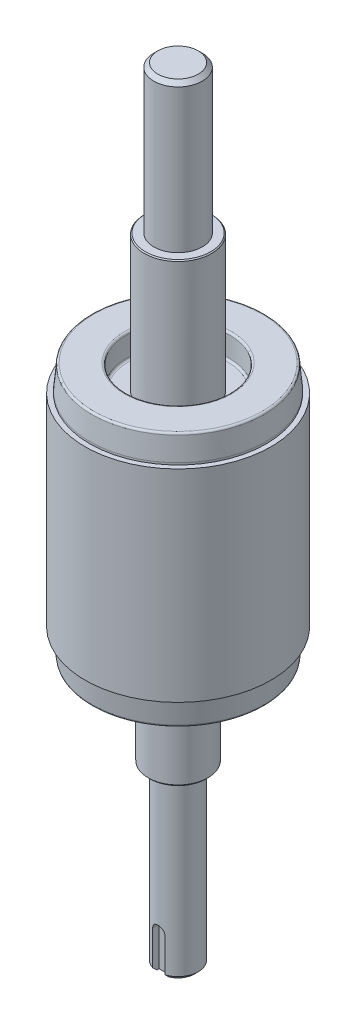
SolidWorks part; units mm, degrees
ref_plane "Plan de face" through (0, 0, 0) normal (0, 0, 1) x (1, 0, 0)
ref_plane "Plan de dessus" through (0, 0, 0) normal (0, 1, 0) x (1, 0, 0)
ref_plane "Plan de droite" through (0, 0, 0) normal (1, 0, 0) x (0, 0, -1)
imported_body "Importée1"
sketch "Esquisse1" plane through (0, -147.3, 0) normal (0, -1, 0) x (1, 0, 0)
  circle A0 centre (0, 0) radius 5
  dimension "D1" = 10
extrude "Boss.-Extru.1" add sketch "Esquisse1" along normal blind 45.95
chamfer "Chanfrein1" distance 1 angle 45 1 edges at (0, -193.25, -5)
sketch "Esquisse3" plane through (0, -36.5, 0) normal (0, 1, 0) x (1, 0, 0)
  circle A1 centre (0, 0) radius 8.07 construction
  circle A2 centre (0, 0) radius 6
  circle A3 centre (0, 0) radius 4.85
  dimension "D1" = 12
  dimension "D2" = 9.7
extrude "Boss.-Extru.2" add sketch "Esquisse3" along normal up to surface (36.5 mm away)
chamfer "Chanfrein2" distance 1 angle 45 1 edges at (0, 0, -6)
ref_plane "plan" through (0, 0, 5) normal (0, 0, 1) x (1, 0, 0)
sketch "Esquisse4" plane through (0, 0, 5) normal (0, 0, 1) x (1, 0, 0)
  line L1 (-4, -193.25) -> (4, -193.25) construction
  line L2 (-1.5, -183.75) -> (-1.5, -193.25)
  line L3 (-1.5, -193.25) -> (1.5, -193.25)
  line L4 (1.5, -183.75) -> (1.5, -193.25)
  arc A0 (-1.5, -183.75) -> (1.5, -183.75) centre (0, -183.75) cw
  dimension "D2" = 1.5
  dimension "D1" = 9.5
  dimension "D3" = 1.5
extrude "Enlèv. mat.-Extru.1" cut sketch "Esquisse4" against normal blind 1.8
sketch "Esquisse5" plane through (0, -122.8, 0) normal (0, -1, 0) x (1, 0, 0)
  circle A0 centre (0, 0) radius 7.4
  dimension "D1" = 14.8
extrude "Boss.-Extru.3" add sketch "Esquisse5" along normal blind 27.2
chamfer "Chanfrein3" distance 0.5 angle 45 1 edges at (0, -150, -7.4)
